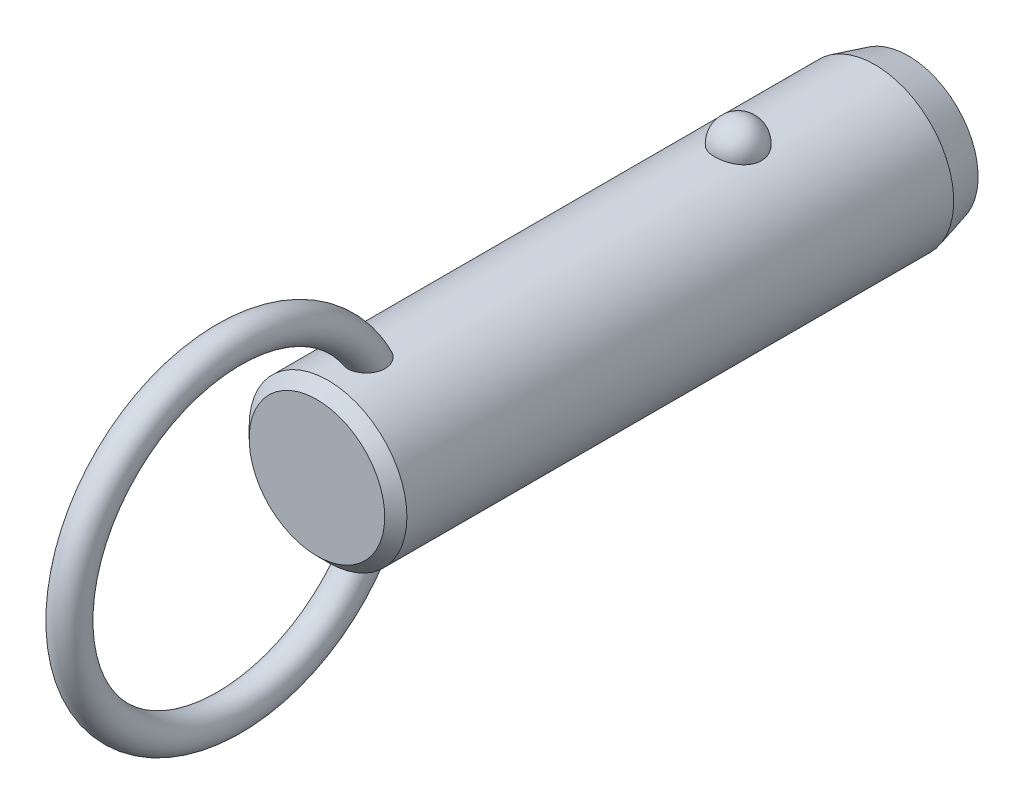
SolidWorks part; units mm, degrees
ref_plane "Front Plane" through (0, 0, 0) normal (0, 0, 1) x (1, 0, 0)
ref_plane "Top Plane" through (0, 0, 0) normal (0, 1, 0) x (1, 0, 0)
ref_plane "Right Plane" through (0, 0, 0) normal (1, 0, 0) x (0, 0, -1)
sketch "Sketch2" plane through (0, 0, 0) normal (0, 0, 1) x (1, 0, 0)
  circle A0 centre (0, 0) radius 7.1
  point P3 (0, 7.1)
  dimension "D1" = 14.2
extrude "Boss-Extrude1" add sketch "Sketch2" along normal blind 27.9
sketch "Sketch3" plane through (0, 0, 0) normal (0, 0, -1) x (-1, 0, 0)
  circle A0 centre (0, 0) radius 7.1
  dimension "D1" = 14.2
extrude "Boss-Extrude2" add sketch "Sketch3" along normal blind 17.4
chamfer "Chamfer1" distance 3 angle 15 1 edges at (-7.1, 0, -17.4)
sketch "Sketch12" plane through (0, 0, 0) normal (1, 0, 0) x (0, 0, -1)
  line L0 (-27.9, 7.1) -> (-27.9, -7.1) construction
  point P0 (-27.9, 0)
sketch "Sketch13" plane through (0, 0, 0) normal (1, 0, 0) x (0, 0, -1)
  circle A0 centre (-43.75, 0) radius 15.85
  point P2 (-27.9, 0)
  dimension "D1" = 31.7
sketch "Sketch14" plane through (0, 0, 0) normal (0, 1, 0) x (1, 0, 0)
  circle A0 centre (0, -29.4) radius 1.5
  point P2 (0, -27.9)
  dimension "D1" = 3
sweep "Sweep1" add profiles "Sketch14" path "Sketch13"
sketch "Sketch15" plane through (0, 0, 27.9) normal (0, 0, 1) x (1, 0, 0)
  circle A0 centre (0, 0) radius 7.1
  dimension "D1" = 14.2
extrude "Boss-Extrude3" add sketch "Sketch15" along normal blind 7.92
chamfer "Chamfer2" distance 1 angle 45 1 edges at (7.1, 0, 35.82)
sketch "Sketch18" plane through (0, 0, 0) normal (1, 0, 0) x (0, 0, -1)
  line L0 (14.4, 7.1) -> (-29.5792, 7.1) construction
  line L1 (2.1, 9.2) -> (2.1, 5)
  line L2 (-29.5792, -7.1) -> (14.4, -7.1) construction
  arc A0 (2.1, 9.2) -> (2.1, 5) centre (2.1, 7.1) ccw
  point P4 (0, 7.1)
  dimension "D1" = 16.3
revolve "Revolve1" add sketch "Sketch18" angle 360 about L1
